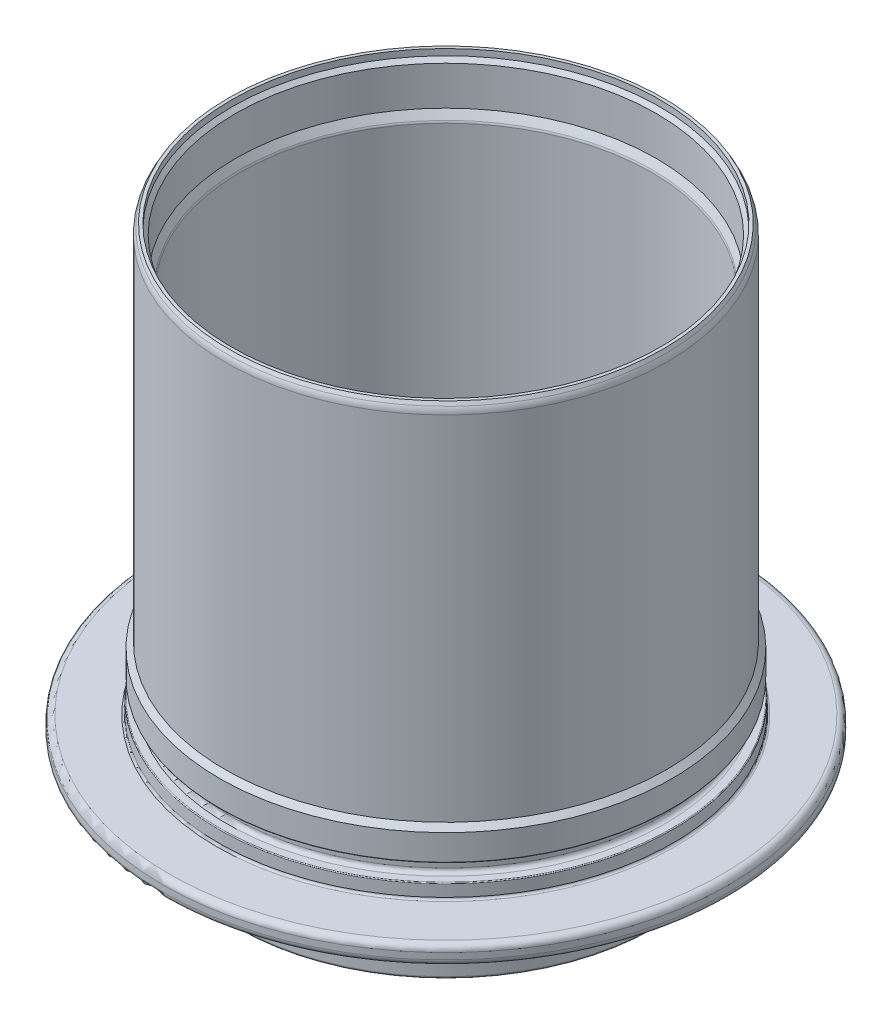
SolidWorks part; units mm, degrees
ref_plane "Plan de face" through (0, 0, 0) normal (0, 0, 1) x (1, 0, 0)
ref_plane "Plan de dessus" through (0, 0, 0) normal (0, 1, 0) x (1, 0, 0)
ref_plane "Plan de droite" through (0, 0, 0) normal (1, 0, 0) x (0, 0, -1)
sketch "Esquisse1" plane through (0, 0, 0) normal (0, 0, 1) x (1, 0, 0)
  line L0 (-120.2567, 137.3869) -> (-120.2567, 54.6295)
  line L1 (-123.5198, 150.5701) -> (-123.0582, 151.3695)
  line L2 (-111.0646, 40.4668) -> (-116.742, 46.1442)
  line L3 (-120.7707, 35.3358) -> (-119.2726, 37.9306)
  line L4 (-123.0582, 151.3695) -> (-122.3217, 151.3657)
  line L5 (-122.3217, 151.3657) -> (-122.3217, 149.8657)
  line L6 (-121.4217, 148.9657) -> (-122.3217, 149.8657)
  line L7 (-121.4217, 148.9657) -> (-121.4217, 139.6726)
  line L8 (-123.9217, 64.874) -> (-123.9217, 149.0701)
  line L9 (-125.1717, 57.524) -> (-125.1717, 63.624)
  line L10 (-125.1717, 53.374) -> (-123.4217, 53.374)
  line L11 (-137.1717, 49.874) -> (-125.8717, 49.874)
  line L12 (-138.6717, 46.874) -> (-138.6717, 48.374)
  line L13 (-119.2726, 41.6267) -> (-121.0031, 44.624)
  line L14 (-119.0717, 40.8767) -> (-119.0717, 38.6806)
  line L15 (-110.6991, 30.374) -> (-120.4717, 30.374)
  line L16 (-114.9967, 34.374) -> (-114.9967, 37.374)
  line L17 (-120.3907, 137.8869) -> (-121.4217, 139.6726)
  line L18 (-123.9217, 64.874) -> (-125.1717, 63.624)
  line L19 (-123.4217, 57.324) -> (-124.9717, 57.324)
  line L20 (-137.1717, 45.374) -> (-122.3021, 45.374)
  line L21 (-110.7717, 39.274) -> (-110.7717, 39.7597)
  line L22 (-120.9717, 30.874) -> (-120.9717, 34.5858)
  line L23 (-113.4967, 38.874) -> (-111.1717, 38.874)
  line L24 (-113.4967, 32.874) -> (-110.5217, 32.874)
  line L25 (-125.3717, 50.374) -> (-125.3717, 53.174)
  line L26 (-122.4217, 54.374) -> (-122.4217, 56.324)
  line L27 (-110.2557, 31.1419) -> (-110.6991, 30.374)
  line L28 (-110.1217, 31.6419) -> (-110.1217, 32.474)
  line L29 (-71.1717, 158.7367) -> (-71.1717, 21.124) construction
  arc A0 (-123.9217, 149.0701) -> (-123.5198, 150.5701) centre (-120.9217, 149.0701) cw
  arc A1 (-114.9967, 34.374) -> (-113.4967, 32.874) centre (-113.4967, 34.374) ccw
  arc A2 (-110.2557, 31.1419) -> (-110.1217, 31.6419) centre (-111.1217, 31.6419) ccw
  arc A3 (-110.1217, 32.474) -> (-110.5217, 32.874) centre (-110.5217, 32.474) ccw
  arc A4 (-120.4717, 30.374) -> (-120.9717, 30.874) centre (-120.4717, 30.874) cw
  arc A5 (-114.9967, 37.374) -> (-113.4967, 38.874) centre (-113.4967, 37.374) cw
  arc A6 (-110.7717, 39.7597) -> (-111.0646, 40.4668) centre (-111.7717, 39.7597) ccw
  arc A7 (-110.7717, 39.274) -> (-111.1717, 38.874) centre (-111.1717, 39.274) cw
  arc A8 (-121.0031, 44.624) -> (-122.3021, 45.374) centre (-122.3021, 43.874) ccw
  arc A9 (-119.2726, 41.6267) -> (-119.0717, 40.8767) centre (-120.5717, 40.8767) cw
  arc A10 (-119.0717, 38.6806) -> (-119.2726, 37.9306) centre (-120.5717, 38.6806) cw
  arc A11 (-120.9717, 34.5858) -> (-120.7707, 35.3358) centre (-119.4717, 34.5858) cw
  arc A12 (-137.1717, 49.874) -> (-138.6717, 48.374) centre (-137.1717, 48.374) ccw
  arc A13 (-138.6717, 46.874) -> (-137.1717, 45.374) centre (-137.1717, 46.874) ccw
  arc A14 (-125.3717, 50.374) -> (-125.8717, 49.874) centre (-125.8717, 50.374) cw
  arc A15 (-125.3717, 53.174) -> (-125.1717, 53.374) centre (-125.1717, 53.174) cw
  arc A16 (-124.9717, 57.324) -> (-125.1717, 57.524) centre (-124.9717, 57.524) cw
  arc A17 (-123.4217, 53.374) -> (-122.4217, 54.374) centre (-123.4217, 54.374) ccw
  arc A18 (-122.4217, 56.324) -> (-123.4217, 57.324) centre (-123.4217, 56.324) ccw
  arc A19 (-120.2567, 137.3869) -> (-120.3907, 137.8869) centre (-121.2567, 137.3869) ccw
  arc A20 (-116.742, 46.1442) -> (-120.2567, 54.6295) centre (-108.2567, 54.6295) cw
  dimension "D1" = 1
  dimension "D2" = 0.4
  dimension "D4" = 0.5
  dimension "D7" = 1.5
  dimension "D8" = 1.5
  dimension "D12" = 1
  dimension "D13" = 0.4
  dimension "D19" = 1.5
  dimension "D20" = 1.5
  dimension "D21" = 0.5
  dimension "D25" = 0.2
  dimension "D26" = 1
  dimension "D36" = 3
  dimension "D37" = 1
  dimension "D39" = 12
  dimension "D3" = 10.85
  dimension "D5" = 30
  dimension "D6" = 1.9
  dimension "D9" = 2.5
  dimension "D10" = 6
  dimension "D11" = 0.65
  dimension "D14" = 30
  dimension "D15" = 30
  dimension "D16" = 15
  dimension "D17" = 17.7
  dimension "D18" = 4.5
  dimension "D22" = 2.95
  dimension "D23" = 4.4
  dimension "D24" = 13.5
  dimension "D27" = 15
  dimension "D28" = 14.75
  dimension "D29" = 1.6
  dimension "D30" = 1.5
  dimension "D31" = 45
  dimension "D32" = 2.5
  dimension "D33" = 3.665
  dimension "D34" = 30
  dimension "D35" = 30
  dimension "D38" = 45
  dimension "D40" = 67.5
revolve "Révolution1" add sketch "Esquisse1" angle 360 about L29
ref_plane "Plan1" through (0, 64.874, 0) normal (0, 1, 0) x (1, 0, 0)
sketch "Esquisse3" plane through (0, 64.874, 0) normal (0, 1, 0) x (1, 0, 0)
  line L0 (-71.1717, 0) -> (-71.1717, -78.1645) construction
  line L1 (-71.1717, -78.1645) -> (-71.1717, 0) construction
  line L2 (-18.764, 6) -> (-22.3444, 5.0236)
  line L3 (-71.1717, 0) -> (-8.6129, 0) construction
  line L4 (-50.164, -48.3864) -> (-51.1086, -44.7974)
  line L5 (-39.7717, -42.3864) -> (-42.4075, -39.7739)
  line L6 (-18.764, -6) -> (-22.3444, -5.0236)
  line L7 (-102.5717, -42.3864) -> (-99.9359, -39.7739)
  line L8 (-92.1794, -48.3864) -> (-91.2348, -44.7974)
  line L9 (-123.5793, 6) -> (-119.9989, 5.0236)
  line L10 (-123.5793, -6) -> (-119.9989, -5.0236)
  line L11 (-92.1794, 48.3864) -> (-91.2348, 44.7974)
  line L12 (-102.5717, 42.3864) -> (-99.9359, 39.7739)
  line L13 (-39.7717, 42.3864) -> (-42.4075, 39.7739)
  line L14 (-50.164, 48.3864) -> (-51.1086, 44.7974)
  arc A0 (-119.9989, -5.0236) -> (-99.9359, -39.7739) centre (-71.1717, 0) ccw
  arc A1 (-92.1794, -48.3864) -> (-50.164, -48.3864) centre (-71.1717, 0) ccw
  arc A2 (-123.5793, -6) -> (-102.5717, -42.3864) centre (-71.1717, 0) ccw
  arc A3 (-91.2348, -44.7974) -> (-51.1086, -44.7974) centre (-71.1717, 0) ccw
  arc A4 (-39.7717, -42.3864) -> (-18.764, -6) centre (-71.1717, 0) ccw
  arc A5 (-42.4075, -39.7739) -> (-22.3444, -5.0236) centre (-71.1717, 0) ccw
  arc A6 (-18.764, 6) -> (-39.7717, 42.3864) centre (-71.1717, 0) ccw
  arc A7 (-22.3444, 5.0236) -> (-42.4075, 39.7739) centre (-71.1717, 0) ccw
  arc A8 (-51.1086, 44.7974) -> (-91.2348, 44.7974) centre (-71.1717, 0) ccw
  arc A9 (-50.164, 48.3864) -> (-92.1794, 48.3864) centre (-71.1717, 0) ccw
  arc A10 (-99.9359, 39.7739) -> (-119.9989, 5.0236) centre (-71.1717, 0) ccw
  arc A11 (-102.5717, 42.3864) -> (-123.5793, 6) centre (-71.1717, 0) ccw
  point P31 (-71.1717, 0)
  point P34 (-71.1717, 0)
  dimension "D3" = 105.5
  dimension "D4" = 98.17
  dimension "D1" = 15.254
  dimension "D2" = 6
  dimension "D5" = 6
extrude "Enlèv. mat.-Extru.2" [suppressed] cut sketch "Esquisse3" along normal blind 52
fillet "Congé1" [suppressed] radius 9
fillet "Congé2" [suppressed] radius 12
hole_wizard "Fraisage pour vis à tête fraisée M51" positions "Esquisse5" profile "Esquisse4" countersink size "M5" standard "Iso"
sketch "Esquisse5" plane through (0, 45.374, 0) normal (0, -1, 0) x (-1, 0, 0)
  circle A0 centre (71.1717, 0) radius 45.5703 construction
  point P0 (11.9217, 0)
  dimension "D1" = 59.25
sketch "Esquisse4" plane through (-11.9217, 45.374, 0) normal (1, 0, 0) x (0, 0, -1)
  line L0 (0, 0) -> (0, 105.9955)
  line L1 (0, 105.9955) -> (2.75, 105.9955)
  line L2 (2.75, 105.9955) -> (2.75, 3.25)
  line L3 (2.75, 3.25) -> (6, 0)
  line L5 (6, 0) -> (0, 0)
  line L6 (-2.75, 3.25) -> (-6, 0) construction
  line L11 (0, -6.35) -> (0, 107.95) construction
  dimension "Diamètre du perçage jusqu'au prochain" = 5.5
  dimension "Profondeur du perçage jusqu'au prochain" = 105.9955
  dimension "Diamètre du fraisage entrant" = 12
  dimension "Angle du fraisage entrant" = 90
pattern_circular "Répétition circulaire1" [suppressed] count 8 over 360
ref_plane "Plan3" [suppressed] through (0, 151.374, 0) normal (0, 1, 0) x (1, 0, 0)
sketch "Esquisse6" [suppressed] plane through (0, 151.374, 0) normal (0, 1, 0) x (1, 0, 0)
  circle A0 centre (-71.1717, 0) radius 51
  circle A1 centre (-71.1717, 0) radius 52.95
extrude "Boss.-Extru.1" [suppressed] add sketch "Esquisse6" against normal blind 90
